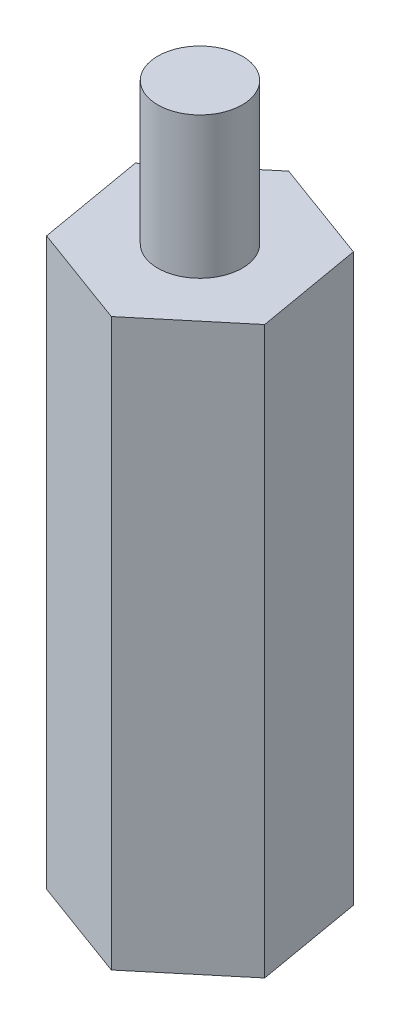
SolidWorks part; units mm, degrees
ref_plane "Front Plane" through (0, 0, 0) normal (0, 0, 1) x (1, 0, 0)
ref_plane "Top Plane" through (0, 0, 0) normal (0, 1, 0) x (1, 0, 0)
ref_plane "Right Plane" through (0, 0, 0) normal (1, 0, 0) x (0, 0, -1)
sketch "Sketch1" plane through (0, 0, 0) normal (0, 1, 0) x (1, 0, 0)
  line L1 (-0.6266, 3.6122) -> (-3.4416, 1.2635)
  line L2 (-3.4416, 1.2635) -> (-2.815, -2.3488)
  line L3 (-2.815, -2.3488) -> (0.6266, -3.6122)
  line L4 (0.6266, -3.6122) -> (3.4416, -1.2635)
  line L5 (3.4416, -1.2635) -> (2.815, 2.3488)
  line L6 (2.815, 2.3488) -> (-0.6266, 3.6122)
  circle A0 centre (0, 0) radius 3.175 construction
  dimension "D1" = 6.35
extrude "Extrude1" add sketch "Sketch1" along normal blind 19.05
sketch "Sketch2" plane through (0, 19.05, 0) normal (0, 1, 0) x (-1, 0, 0)
  circle A0 centre (0, 0) radius 1.4224
  dimension "D1" = 2.8448
extrude "Extrude2" add sketch "Sketch2" along normal blind 4.7625
sketch "Sketch3" plane through (0, 0, 0) normal (0, -1, 0) x (1, 0, 0)
  circle A0 centre (0, 0) radius 1.4224
  dimension "D1" = 2.8448
extrude "Cut-Extrude1" cut sketch "Sketch3" against normal blind 5.08
